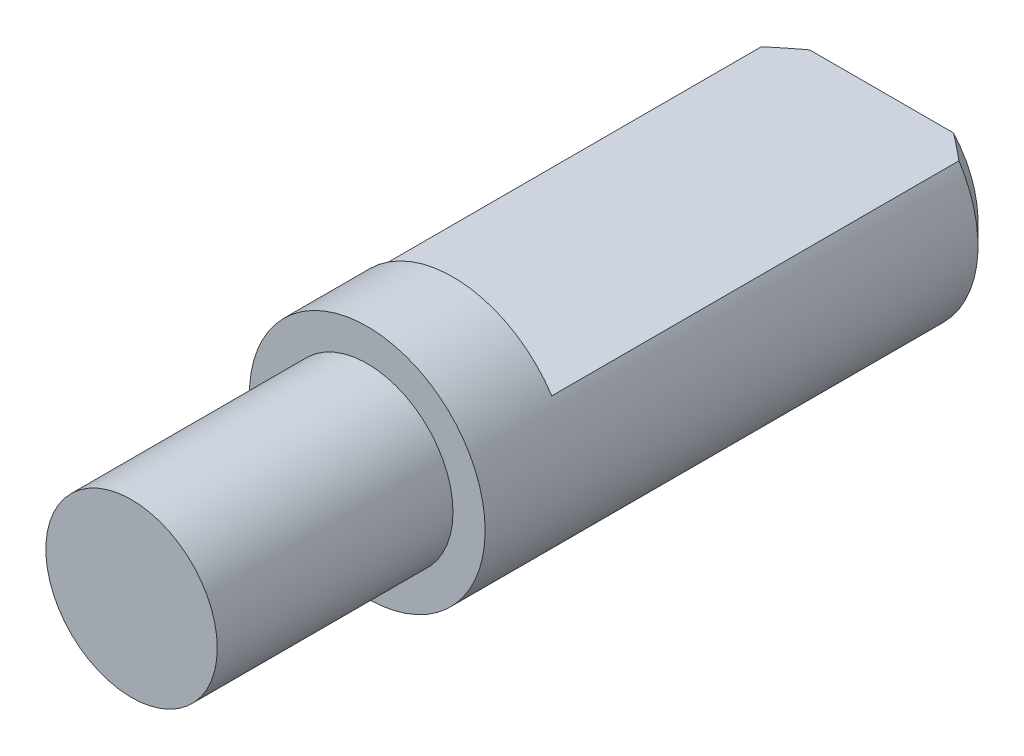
SolidWorks part; units mm, degrees
ref_plane "Plan de face" through (0, 0, 0) normal (0, 0, 1) x (1, 0, 0)
ref_plane "Plan de dessus" through (0, 0, 0) normal (0, 1, 0) x (1, 0, 0)
ref_plane "Plan de droite" through (0, 0, 0) normal (1, 0, 0) x (0, 0, -1)
sketch "Esquisse7" plane through (0, 0, 0) normal (0, 0, 1) x (1, 0, 0)
  circle A0 centre (0, 0) radius 12.5
  dimension "D1" = 25
extrude "Extrusion2" add sketch "Esquisse7" along normal blind 70
sketch "Esquisse1" plane through (0, 0, 0) normal (0, 0, 1) x (1, 0, 0)
  circle A0 centre (0, 0) radius 11
  dimension "D1" = 22
extrude "Enlèv. mat.-Extru.1" cut sketch "Esquisse1" along normal blind 48 flip side to cut
chamfer "Chanfrein1" distance 2 angle 45 1 edges at (11, 0, 0)
sketch "Esquisse8" plane through (0, 0, 70) normal (0, 0, 1) x (1, 0, 0)
  circle A0 centre (0, 0) radius 8
  dimension "D1" = 16
extrude "Enlèv. mat.-Extru.3" cut sketch "Esquisse8" against normal blind 22 flip side to cut
ref_plane "Plan1" through (0, 6, 0) normal (0, 1, 0) x (-1, 0, 0)
sketch "Esquisse3" plane through (0, 6, 0) normal (0, 1, 0) x (-1, 0, 0)
  line L1 (-21.3487, 40) -> (19.1402, 40)
  line L2 (-21.3487, 40) -> (-21.3487, -4.6115)
  line L3 (-21.3487, -4.6115) -> (19.1402, -4.6115)
  line L4 (19.1402, 40) -> (19.1402, -4.6115)
  line L6 (11, 48) -> (-11, 48) construction
  dimension "D1" = 8
extrude "Enlèv. mat.-Extru.2" cut sketch "Esquisse3" along normal blind 48
sketch "Esquisse9" plane through (0, 0, 0) normal (0, 0, -1) x (-1, 0, 0)
  point P0 (0, 0)
sketch "Esquisse10" plane through (0, 0, 70) normal (0, 0, 1) x (1, 0, 0)
  point P0 (0, 0)
